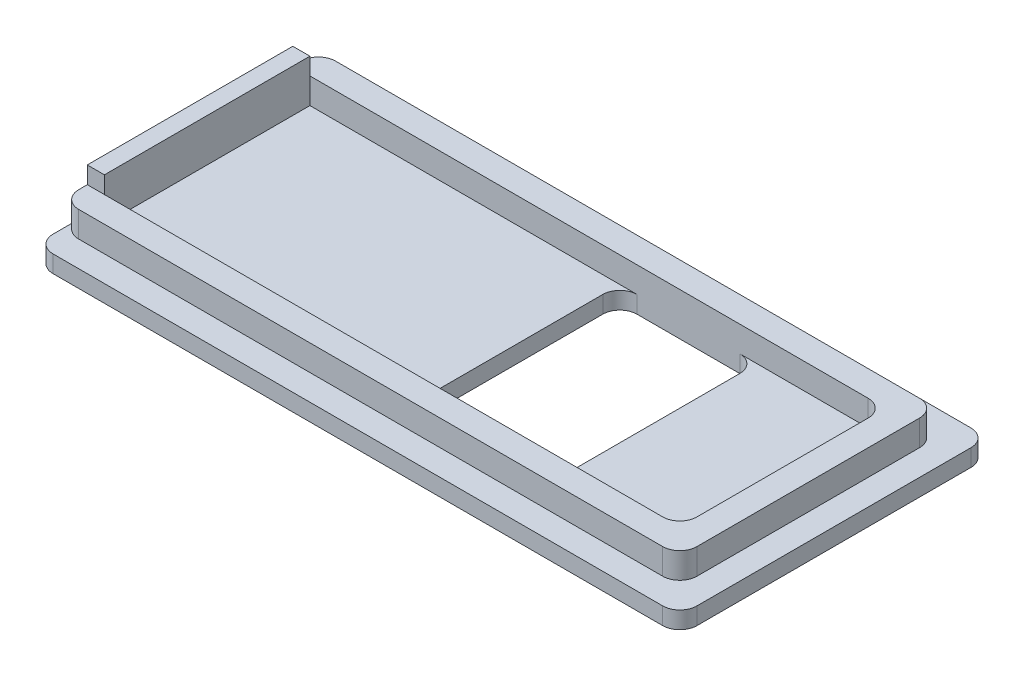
SolidWorks part; units mm, degrees
ref_plane "Alzado" through (0, 0, 0) normal (0, 0, 1) x (1, 0, 0)
ref_plane "Planta" through (0, 0, 0) normal (0, 1, 0) x (1, 0, 0)
ref_plane "Vista lateral" through (0, 0, 0) normal (1, 0, 0) x (0, 0, -1)
sketch "Croquis1" plane through (0, 0, 0) normal (0, 1, 0) x (1, 0, 0)
  line L1 (0, 0) -> (37.6, 0)
  line L2 (0, 0) -> (0, 18)
  line L3 (0, 18) -> (37.6, 18)
  line L4 (37.6, 0) -> (37.6, 18)
  dimension "D1" = 37.6
  dimension "D2" = 18
extrude "Saliente-Extruir1" add sketch "Croquis1" along normal blind 1
sketch "Croquis3" plane through (0, 1, 0) normal (0, 1, 0) x (1, 0, 0)
  line L0 (37.6, 18) -> (0, 18) construction
  line L1 (0, 16.5) -> (36.1, 16.5)
  line L2 (0, 16.5) -> (0, 1.5)
  line L3 (0, 1.5) -> (36.1, 1.5)
  line L4 (36.1, 16.5) -> (36.1, 1.5)
  line L5 (0, 15) -> (34.6, 15)
  line L6 (0, 15) -> (0, 3)
  line L7 (0, 3) -> (34.6, 3)
  line L8 (34.6, 15) -> (34.6, 3)
  line L9 (0, 0) -> (37.6, 0) construction
  line L10 (37.6, 0) -> (37.6, 18) construction
  line L11 (0, 18) -> (0, 0) construction
  dimension "D1" = 1.5
  dimension "D2" = 1.5
  dimension "D3" = 1.5
  dimension "D4" = 0
  dimension "D5" = 0
  dimension "D6" = 1.5
  dimension "D7" = 1.5
  dimension "D8" = 1.5
extrude "Saliente-Extruir3" add sketch "Croquis3" along normal blind 1.5 contours L5 L8 L7 L3 L4 L1 M9
sketch "Croquis4" plane through (0, 1, 0) normal (0, 1, 0) x (1, 0, 0)
  line L0 (0, 15) -> (1, 15)
  line L1 (0, 15) -> (34.6, 15) construction
  line L2 (1, 15) -> (1, 3)
  line L3 (0, 3) -> (34.6, 3) construction
  line L4 (1, 3) -> (0, 3)
  line L5 (0, 3) -> (0, 15)
  dimension "D1" = 1
extrude "Saliente-Extruir4" add sketch "Croquis4" along normal blind 2.5
sketch "Croquis5" plane through (0, 1, 0) normal (0, 1, 0) x (1, 0, 0)
  line L0 (1, 15) -> (34.6, 15) construction
  line L1 (19.1, 15) -> (27.1, 15)
  line L2 (19.1, 15) -> (19.1, 3)
  line L3 (19.1, 3) -> (27.1, 3)
  line L4 (27.1, 15) -> (27.1, 3)
  line L5 (1, 3) -> (34.6, 3) construction
  line L7 (36.1, 16.5) -> (36.1, 1.5) construction
  dimension "D1" = 9
  dimension "D2" = 8
extrude "Cortar-Extruir1" cut sketch "Croquis5" against normal through all
fillet "Redondeo9" radius 1 9 edges at (36.1, 1.75, -1.5) (0, 0.5, -18) (34.6, 1.75, -15) (34.6, 1.75, -3) (36.1, 1.75, -16.5) (37.6, 0.5, -18) (37.6, 0.5, 0) (0, 0.5, 0)
fillet "Redondeo10" radius 1 1 edges
fillet "Redondeo11" radius 1 4 edges
